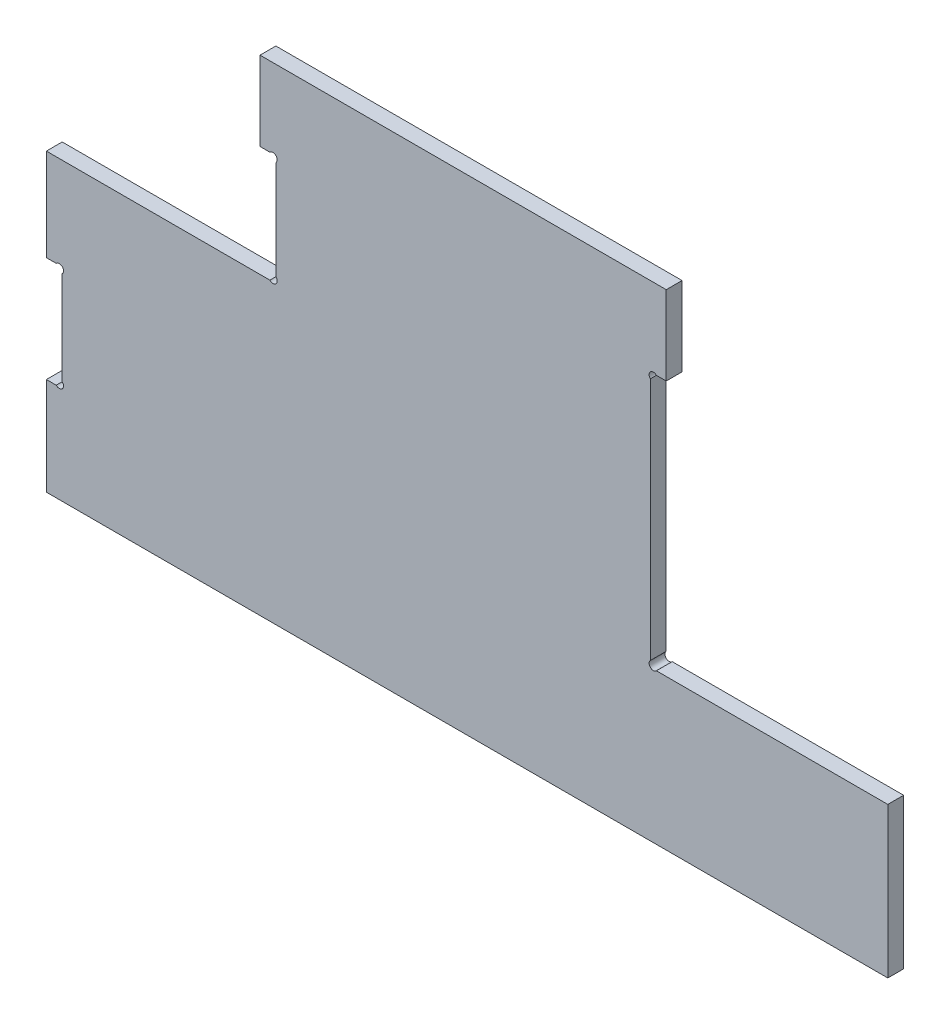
SolidWorks part; units mm, degrees
ref_plane "Face" through (0, 0, 0) normal (0, 0, 1) x (1, 0, 0)
ref_plane "Dessus" through (0, 0, 0) normal (0, 1, 0) x (1, 0, 0)
ref_plane "Droite" through (0, 0, 0) normal (1, 0, 0) x (0, 0, -1)
sketch "Esquisse1" plane through (0, 0, 0) normal (0, 0, 1) x (1, 0, 0)
  line L0 (132.8174, -51.0303) -> (222.8174, -51.0303)
  line L1 (-15.1826, 75.9697) -> (132.8174, 75.9697)
  line L2 (-15.1826, 75.9697) -> (-15.1826, -108.0303)
  line L3 (118.8174, -108.0303) -> (-15.1826, -108.0303)
  line L4 (132.8174, 75.9697) -> (132.8174, -51.0303)
  line L5 (222.8174, -51.0303) -> (222.8174, -108.0303)
  line L6 (222.8174, -108.0303) -> (118.8174, -108.0303)
  dimension "D1" = 184
  dimension "D2" = 238
  dimension "D4" = 57
  dimension "D7" = 90
extrude "Base-Extrusion" add sketch "Esquisse1" along normal blind 6
sketch "Esquisse8" plane through (132.8174, 0, 0) normal (1, 0, 0) x (0, 0, -1)
  line L0 (0, -51.0303) -> (0, 75.9697) construction
  line L1 (-6, 75.9697) -> (0, 75.9697)
  line L2 (-6, 75.9697) -> (-6, 45.9697)
  line L3 (-6, 45.9697) -> (0, 45.9697)
  line L4 (0, 75.9697) -> (0, 45.9697)
  dimension "D1" = 30
extrude "Extrusion1" add sketch "Esquisse8" along normal blind 6
sketch "Esquisse9" plane through (-15.1826, 0, 0) normal (-1, 0, 0) x (0, 0, 1)
  line L0 (0, 75.9697) -> (0, -108.0303) construction
  line L1 (6, -108.0303) -> (0, -108.0303)
  line L2 (6, -108.0303) -> (6, 3.9697)
  line L3 (6, 3.9697) -> (0, 3.9697)
  line L4 (0, -108.0303) -> (0, 3.9697)
  dimension "D1" = 112
extrude "Extrusion2" add sketch "Esquisse9" along normal blind 81
sketch "Esquisse10" plane through (0, 0, 6) normal (0, 0, 1) x (1, 0, 0)
  line L0 (-96.1826, -108.0303) -> (-96.1826, 3.9697) construction
  line L1 (-96.1826, -31.0303) -> (-90.1826, -31.0303)
  line L2 (-96.1826, -31.0303) -> (-96.1826, -71.0303)
  line L3 (-96.1826, -71.0303) -> (-90.1826, -71.0303)
  line L4 (-90.1826, -31.0303) -> (-90.1826, -71.0303)
  line L5 (-96.1826, 3.9697) -> (-15.1826, 3.9697) construction
  dimension "D1" = 6
  dimension "D2" = 35
  dimension "D3" = 40
extrude "Enlèv. mat.-Extru.5" cut sketch "Esquisse10" against normal up to vertex (6 mm away)
sketch "Esquisse11" plane through (0, 0, 6) normal (0, 0, 1) x (1, 0, 0)
  line L0 (-15.1826, 75.9697) -> (-15.1826, 3.9697) construction
  line L1 (-15.1826, 45.9697) -> (-9.1826, 45.9697)
  line L2 (-15.1826, 45.9697) -> (-15.1826, 3.9697)
  line L3 (-15.1826, 3.9697) -> (-9.1826, 3.9697)
  line L4 (-9.1826, 45.9697) -> (-9.1826, 3.9697)
  line L5 (138.8174, 75.9697) -> (-15.1826, 75.9697) construction
  dimension "D1" = 6
  dimension "D2" = 42
  dimension "D3" = 30
extrude "Enlèv. mat.-Extru.6" cut sketch "Esquisse11" against normal up to vertex (6 mm away)
sketch "Esquisse6" plane through (0, 0, 0) normal (0, 0, -1) x (-1, 0, 0)
  line L0 (-222.8174, -51.0303) -> (-132.8174, -51.0303) construction
  line L1 (-132.8174, -51.0303) -> (-132.8174, 45.9697) construction
  line L2 (-138.8174, 45.9697) -> (-132.8174, 45.9697) construction
  line L4 (-132.8174, -51.0303) -> (-132.8174, 45.9697) construction
  line L6 (90.1826, -31.0303) -> (96.1826, -31.0303) construction
  line L7 (90.1826, -71.0303) -> (90.1826, -31.0303) construction
  line L8 (96.1826, -71.0303) -> (90.1826, -71.0303) construction
  line L10 (9.1826, 3.9697) -> (9.1826, 45.9697) construction
  line L11 (9.1826, 45.9697) -> (15.1826, 45.9697) construction
  line L12 (96.1826, 3.9697) -> (9.1826, 3.9697) construction
  circle A0 centre (-133.9174, -49.9303) radius 1.6
  circle A1 centre (-133.9174, 44.8697) radius 1.6
  circle A2 centre (91.2826, -32.1303) radius 1.6
  circle A3 centre (91.2826, -69.9303) radius 1.6
  circle A4 centre (10.2826, 44.8697) radius 1.6
  circle A5 centre (10.2826, 5.0697) radius 1.6
  dimension "D1" = 1.1
  dimension "D3" = 1.1
  dimension "D4" = 1.1
  dimension "D5" = 1.1
  dimension "D9" = 1.1
  dimension "D2" = 1.1
  dimension "D6" = 1.1
  dimension "D7" = 1.1
  dimension "D8" = 1.1
  dimension "D10" = 1.1
  dimension "D11" = 1.1
  dimension "D12" = 1.1
extrude "Enlèv. mat.-Extru.4" cut sketch "Esquisse6" against normal up to vertex (6 mm away)
